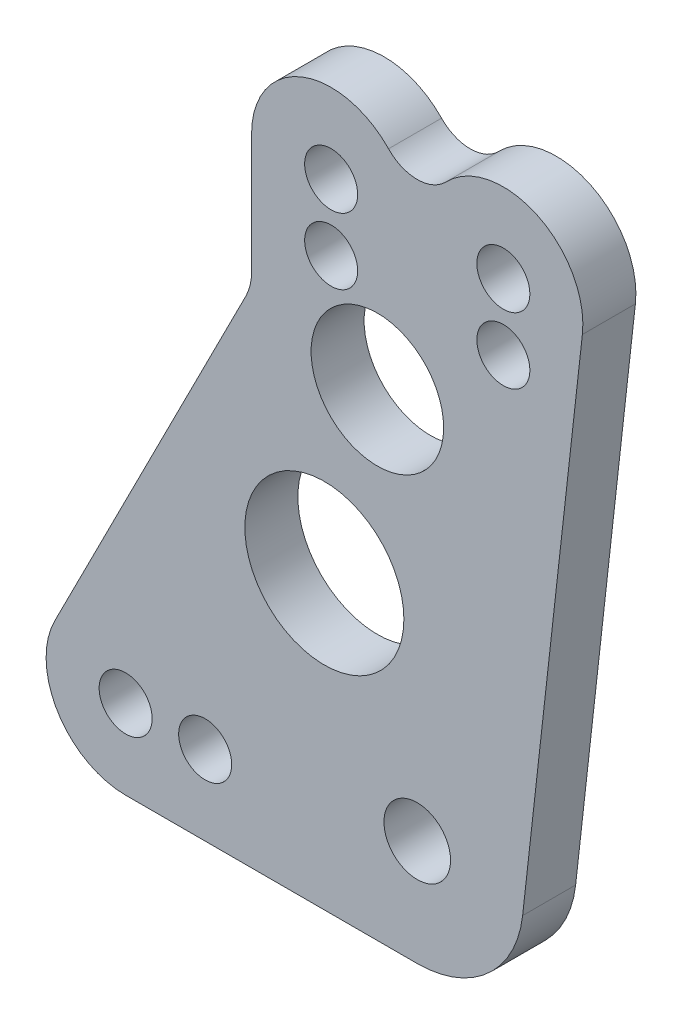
SolidWorks part; units mm, degrees
ref_plane "Front Plane" through (0, 0, 0) normal (0, 0, 1) x (1, 0, 0)
ref_plane "Top Plane" through (0, 0, 0) normal (0, 1, 0) x (1, 0, 0)
ref_plane "Right Plane" through (0, 0, 0) normal (1, 0, 0) x (0, 0, -1)
sketch "Sketch1" plane through (0, 0, 0) normal (0, 0, 1) x (1, 0, 0)
  line L0 (0, 0) -> (0, 22.5668) construction
  line L2 (12.621, -1.4146) -> (19.7781, 62.439)
  line L3 (-34.925, -12.7) -> (0, -12.7)
  line L4 (-19.8374, 63.5) -> (-19.8374, 47.625)
  line L5 (-19.8374, 47.625) -> (-43.4197, 1.1339)
  circle A0 centre (0, 0) radius 3.9878
  circle A1 centre (10.3124, 63.5) radius 3.175
  circle A2 centre (-10.3124, 63.5) radius 3.175
  circle A3 centre (-34.925, -3.175) radius 3.175
  circle A4 centre (-10.3124, 63.5) radius 9.525
  circle A5 centre (10.3124, 63.5) radius 9.525
  circle A6 centre (-34.925, -3.175) radius 9.525
  circle A7 centre (0, 0) radius 12.7
  circle A8 centre (0, 73.3887) radius 4.7625
  circle A9 centre (-25.4, -3.175) radius 3.175
  circle A10 centre (-11.1252, 22.225) radius 9.525
  circle A11 centre (-4.7752, 44.45) radius 7.9375
  dimension "D1" = 7.9756
  dimension "D5" = 19.05
  dimension "D6" = 9.525
  dimension "D8" = 6.35
  dimension "D9" = 19.05
  dimension "D10" = 9.525
  dimension "D14" = 19.05
  dimension "D15" = 15.875
  dimension "D2" = 20.6248
  dimension "D3" = 63.5
  dimension "D4" = 34.925
  dimension "D7" = 3.175
  dimension "D11" = 22.225
  dimension "D12" = 44.45
  dimension "D13" = 11.1252
  dimension "D16" = 4.7752
  dimension "D17" = 15.875
sketch "Sketch2" plane through (0, 0, 0) normal (0, 0, 1) x (1, 0, 0)
  line L0 (-34.925, -12.7) -> (0, -12.7) construction
  line L1 (12.621, -1.4146) -> (19.7781, 62.439) construction
  line L3 (-34.925, -12.7) -> (0, -12.7)
  line L4 (12.621, -1.4146) -> (19.7781, 62.439)
  line L5 (-19.8374, 63.5) -> (-19.8374, 47.625) construction
  line L6 (-19.8374, 47.625) -> (-43.4197, 1.1339) construction
  line L7 (-19.8374, 63.5) -> (-19.8374, 47.625)
  line L8 (-19.8374, 47.625) -> (-43.4197, 1.1339)
  circle A0 centre (-34.925, -3.175) radius 9.525 construction
  circle A1 centre (0, 0) radius 12.7 construction
  circle A2 centre (10.3124, 63.5) radius 9.525 construction
  circle A3 centre (10.3124, 63.5) radius 3.175 construction
  circle A4 centre (0, 73.3887) radius 4.7625 construction
  circle A5 centre (-10.3124, 63.5) radius 9.525 construction
  circle A6 centre (-10.3124, 63.5) radius 3.175 construction
  circle A7 centre (0, 0) radius 3.9878 construction
  circle A8 centre (-34.925, -3.175) radius 3.175 construction
  arc A9 (-43.4197, 1.1339) -> (-34.925, -12.7) centre (-34.925, -3.175) ccw
  arc A10 (0, -12.7) -> (12.621, -1.4146) centre (0, 0) ccw
  arc A11 (19.7781, 62.439) -> (3.4375, 70.0925) centre (10.3124, 63.5) ccw
  circle A12 centre (10.3124, 63.5) radius 3.175
  arc A13 (-3.4375, 70.0925) -> (3.4375, 70.0925) centre (0, 73.3887) ccw
  arc A14 (-3.4375, 70.0925) -> (-19.8374, 63.5) centre (-10.3124, 63.5) ccw
  circle A15 centre (-10.3124, 63.5) radius 3.175
  circle A16 centre (0, 0) radius 3.9878
  circle A17 centre (-34.925, -3.175) radius 3.175
  circle A18 centre (-25.4, -3.175) radius 3.175 construction
  circle A19 centre (-25.4, -3.175) radius 3.175
  circle A20 centre (-11.1252, 22.225) radius 9.525 construction
  circle A21 centre (-4.7752, 44.45) radius 7.9375 construction
  circle A22 centre (-11.1252, 22.225) radius 9.525
  circle A23 centre (-4.7752, 44.45) radius 7.9375
extrude "Boss-Extrude1" add sketch "Sketch2" along normal blind 6.35
sketch "Sketch3" plane through (0, 0, 0) normal (0, 0, 1) x (1, 0, 0)
  line L0 (0, 0) -> (0, 136.4248) construction
  line L1 (0, 0) -> (-40.5048, 0) construction
  line L2 (0, 0) -> (73.0173, 0) construction
  line L3 (0, 0) -> (-34.925, -3.175) construction
  line L4 (-34.925, -3.175) -> (-79.33, -7.2118) construction
sketch "Sketch4" plane through (0, 0, 0) normal (0, 1, 0) x (1, 0, 0)
  line L0 (0, 0) -> (0, -33.0434) construction
ref_plane "Plane1" through (0, 0, 0) normal (0.0905, -0.9959, 0) x (-0.9959, -0.0905, 0)
sketch "Sketch5" plane through (0, 0, 0) normal (0, 0, 1) x (1, 0, 0)
  line L0 (0, 0) -> (0, 17.5568) construction
  circle A0 centre (10.3124, 55.5752) radius 3.175
  circle A1 centre (-10.3124, 55.5752) radius 3.175
  circle A2 centre (10.3124, 63.5) radius 3.175 construction
  dimension "D3" = 6.35
  dimension "D4" = 7.9248
  dimension "D1" = 20.6248
  dimension "D2" = 55.5752
extrude "Cut-Extrude1" cut sketch "Sketch5" along normal blind 7.62
fillet "Fillet1" radius 6.35 1 edges at (-19.8374, 47.625, 3.175)
